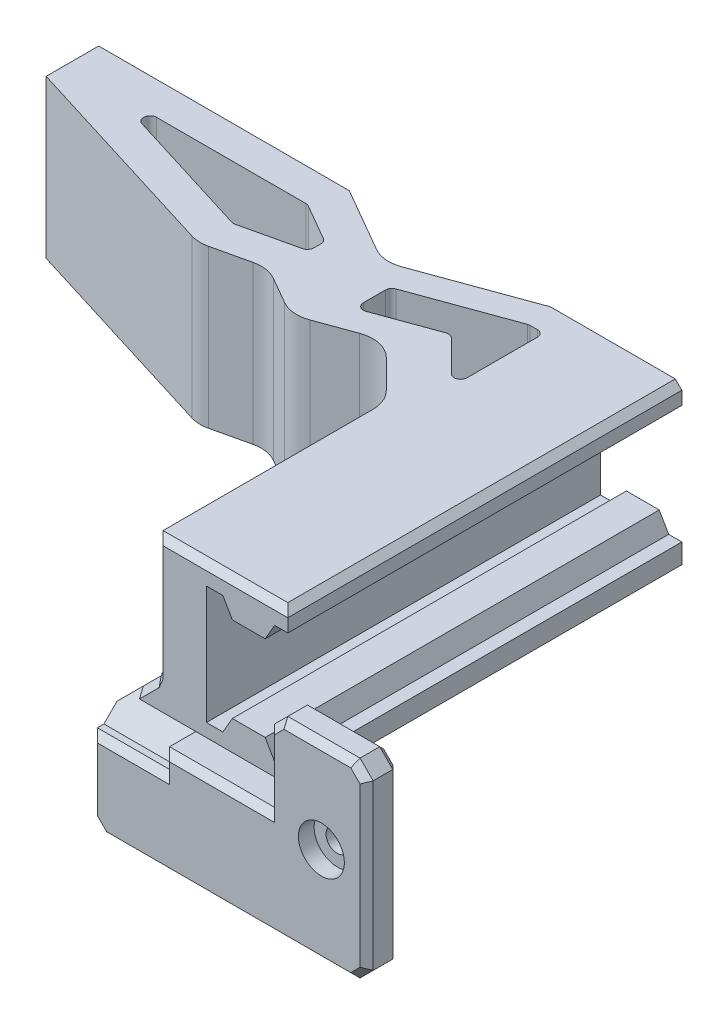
SolidWorks part; units mm, degrees
ref_plane "Front Plane" through (0, 0, 0) normal (0, 0, 1) x (1, 0, 0)
ref_plane "Top Plane" through (0, 0, 0) normal (0, 1, 0) x (1, 0, 0)
ref_plane "Right Plane" through (0, 0, 0) normal (1, 0, 0) x (0, 0, -1)
sketch "Sketch1" plane through (0, 0, 0) normal (0, 0, 1) x (1, 0, 0)
  line L0 (-1, -9) -> (-4.6132, -9) construction
  line L1 (-4.6132, -9) -> (-6.0566, -6.5) construction
  line L2 (-6.0566, -6.5) -> (-11.0566, -6.5) construction
  line L3 (-11.0566, -6.5) -> (-12.5, -9) construction
  line L4 (-12.5, -9) -> (-14, -9) construction
  line L5 (-15, -8) -> (-15, 8) construction
  line L6 (-4.6132, 9) -> (-1, 9) construction
  line L7 (-6.0566, 6.5) -> (-4.6132, 9) construction
  line L8 (-11.0566, 6.5) -> (-6.0566, 6.5) construction
  line L9 (-12.5, 9) -> (-11.0566, 6.5) construction
  line L10 (-14, 9) -> (-12.5, 9) construction
  line L11 (-2.6132, -9) -> (-4.6132, -9)
  line L12 (-4.6132, -9) -> (-6.0566, -6.5)
  line L13 (-6.0566, -6.5) -> (-11.0566, -6.5)
  line L14 (-11.0566, -6.5) -> (-12.5, -9)
  line L15 (-12.5, -9) -> (-14, -9)
  line L16 (-15, -8) -> (-15, 8)
  line L17 (-4.6132, 9) -> (-2.6132, 9)
  line L18 (-6.0566, 6.5) -> (-4.6132, 9)
  line L19 (-11.0566, 6.5) -> (-6.0566, 6.5)
  line L20 (-12.5, 9) -> (-11.0566, 6.5)
  line L21 (-14, 9) -> (-12.5, 9)
  line L22 (-14, -9) -> (-15, -9)
  line L23 (-15, -8) -> (-15, -9)
  line L24 (-14, 9) -> (-15, 9)
  line L25 (-15, 8) -> (-15, 9)
  line L26 (-2.6132, 9) -> (-2.6132, 12)
  line L27 (-2.6132, 12) -> (-22.6132, 12)
  line L28 (-22.6132, 12) -> (-22.6132, -12)
  line L29 (-22.6132, 0) -> (-15, 0) construction
  line L30 (-2.6132, -12) -> (-22.6132, -12)
  line L31 (-2.6132, -9) -> (-2.6132, -12)
  dimension "D1" = 2
  dimension "D2" = 3
  dimension "D3" = 20
extrude "Boss-Extrude1" add sketch "Sketch1" along normal mid plane 60
sketch "Sketch2" plane through (0, -12, 0) normal (0, -1, 0) x (1, 0, 0)
  line L1 (-22.6132, 30) -> (-27.6132, 30)
  line L2 (-22.6132, 30) -> (-22.6132, 5) construction
  line L3 (-22.6132, 5) -> (-27.6132, 5)
  line L4 (-27.6132, 30) -> (-27.6132, 5)
  line L5 (-22.6132, 30) -> (-14.6132, 30)
  line L6 (-22.6132, 30) -> (-22.6132, 5) construction
  line L7 (-22.6132, 5) -> (-14.6132, 5)
  line L8 (-14.6132, 30) -> (-14.6132, 5)
  dimension "D1" = 25
  dimension "D2" = 5
  dimension "D3" = 8
extrude "Boss-Extrude2" add sketch "Sketch2" along normal blind 15
chamfer "Chamfer1" distance 5 angle 45 2 edges at (-22.6132, -12, 17.5) (-14.6132, -12, 17.5)
sketch "Sketch3" plane through (0, 0, 30) normal (0, 0, 1) x (1, 0, 0)
  line L1 (-27.6132, -27) -> (14.3868, -27)
  line L2 (-27.6132, -27) -> (-27.6132, -14)
  line L3 (-27.6132, -14) -> (14.3868, -14)
  line L4 (14.3868, -27) -> (14.3868, -14)
  dimension "D1" = 13
  dimension "D2" = 42
extrude "Boss-Extrude3" add sketch "Sketch3" along normal blind 5
sketch "Sketch4" plane through (0, 0, 35) normal (0, 0, 1) x (1, 0, 0)
  line L1 (14.3868, -14) -> (-16.6132, -14)
  line L2 (14.3868, -14) -> (14.3868, -10.4295)
  line L3 (-0.6132, -11) -> (-16.6132, -11)
  line L4 (-16.6132, -14) -> (-16.6132, -11)
  line L6 (14.3868, -10.4295) -> (14.3868, 2)
  line L7 (14.3868, 2) -> (-0.6132, 2)
  line L8 (-0.6132, -11) -> (-0.6132, 2)
  dimension "D1" = 15
  dimension "D2" = 31
  dimension "D3" = 3
  dimension "D4" = 13
extrude "Boss-Extrude4" add sketch "Sketch4" against normal blind 5
chamfer "Chamfer2" distance 3 angle 45 2 edges at (-6.1132, -12, 30) (-22.1132, -14, 30)
chamfer "Chamfer3" distance 2 angle 45 4 edges at (14.3868, -27, 32.5) (14.3868, 2, 32.5) (-27.6132, -27, 20) (-0.6132, 2, 32.5)
chamfer "Chamfer4" distance 1 angle 45 32 edges at (-2.6132, 12, 0) (-22.6132, -7, 17.5) (-16.1132, -12, 5) (-22.6132, -9.5, 5) (-25.1132, -9.5, 5) (-27.6132, -18.5, 5) (-26.6132, -26, 5) (-20.1132, -27, 5) (-14.6132, -27, 17.5) (-14.6132, -22, 30) (-1.1132, -27, 30) (13.3868, -26, 30) (14.3868, -12.5, 30) (13.3868, 1, 30) (-0.6132, -5.5, 35) (-0.6132, -5.5, 30) (0.3868, 1, 30) (6.8868, 2, 35) (6.8868, 2, 30) (-26.6132, -26, 35) (-27.6132, -19.5, 35) (-22.1132, -14, 35) (-16.6132, -12.5, 35) (-8.6132, -11, 35) (0.3868, 1, 35) (13.3868, 1, 35) (14.3868, -12.5, 35) (13.3868, -26, 35) (-6.6132, -27, 35) (-24.6132, -9, 30) (-22.6132, 2.5, 30) (-12.6132, 12, 30)
sketch "Sketch5" plane through (0, 12, 0) normal (0, 1, 0) x (1, 0, 0)
  line L0 (-22.6132, 30) -> (-22.6132, 16)
  line L1 (-22.6132, 30) -> (-41.4071, 23.1596)
  line L2 (-22.6132, 16) -> (-41.4071, 9.1596)
  line L3 (-41.4071, 23.1596) -> (-41.4071, 9.1596)
  line L4 (-22.6132, -29) -> (-22.6132, 30) construction
  dimension "D1" = 14
  dimension "D2" = 20
  dimension "D3" = 70
extrude "Boss-Extrude5" add sketch "Sketch5" against normal up to surface (24 mm away)
chamfer "Chamfer5" distance 11 angle 45 1 edges at (-22.6132, 0, -16)
sketch "Sketch6" plane through (0, 12, 0) normal (0, 1, 0) x (1, 0, 0)
  line L11 (-32.046, 16.8235) -> (-26.5409, 18.8272)
  line L12 (-25.7282, 18.0144) -> (-17.6635, 9.9497)
  line L13 (-25.7282, 18.0144) -> (-19.6132, 11.8995)
  line L14 (-37.4071, 14.8722) -> (-32.046, 16.8235)
  line L15 (-37.4071, 20.3588) -> (-37.4071, 14.8722)
  line L16 (-21.9079, 26) -> (-37.4071, 20.3588)
  line L17 (-3.6132, 26) -> (-21.9079, 26)
  line L18 (-37.4071, 14.8722) -> (-32.046, 16.8235)
  line L19 (-37.4071, 20.3588) -> (-37.4071, 14.8722)
  line L20 (-21.9079, 26) -> (-37.4071, 20.3588)
  line L21 (-19.6132, 26) -> (-21.9079, 26)
  line L22 (-25.7282, 18.0144) -> (-26.5409, 18.8272)
  line L23 (-19.6132, 26) -> (-19.6132, 11.8995)
  line L24 (-2.6132, 30) -> (-2.6132, -30) construction
  dimension "D3" = 17
  dimension "D1" = 4
  dimension "D2" = 7
extrude "Cut-Extrude1" cut sketch "Sketch6" against normal through all
sketch "Sketch7" plane through (0, 12, 0) normal (0, 1, 0) x (1, 0, 0)
  line L0 (-22.6132, 30) -> (-72.4312, 30) construction
  line L1 (-41.4071, 23.1596) -> (-53.255, 30)
  line L2 (-53.255, 30) -> (-91.4071, 30)
  line L3 (-91.4071, 30) -> (-91.4071, 22)
  line L4 (-91.4071, 22) -> (-57.9734, 11.6469)
  line L5 (-57.9734, 11.6469) -> (-49.2013, 13.6596)
  line L6 (-49.2013, 13.6596) -> (-41.4071, 9.1596)
  line L7 (-41.4071, 23.1596) -> (-41.4071, 9.1596) construction
  line L8 (-48.4036, 21.4255) -> (-54.5948, 25)
  line L9 (-54.5948, 25) -> (-84.192, 25)
  line L10 (-84.192, 25) -> (-84.192, 25)
  line L11 (-84.192, 25) -> (-57.7799, 16.8212)
  line L12 (-57.7799, 16.8212) -> (-48.4036, 18.9725)
  line L14 (-48.4036, 18.9725) -> (-48.4036, 21.4255)
  line L16 (-43.9071, 18.8295) -> (-54.5948, 25) construction
  line L17 (-48.4036, 18.9725) -> (-38.9071, 13.4897) construction
  dimension "D1" = 50
  dimension "D2" = 8
  dimension "D3" = 35
  dimension "D4" = 9
  dimension "D5" = 9
  dimension "D6" = 60
  dimension "D7" = 5
extrude "Boss-Extrude6" add sketch "Sketch7" against normal up to surface (24 mm away) contours L5 L6 L1 L2 L3 L4 L14 L12 L11 L9 L8 M18
sketch "Sketch8" plane through (0, 0, -30) normal (0, 0, -1) x (-1, 0, 0)
  line L0 (91.4071, 0) -> (81.4071, 0) construction
  line L1 (91.4071, -12) -> (91.4071, 12) construction
  line L3 (76.4071, -5) -> (86.4071, -5)
  line L4 (76.4071, -5) -> (76.4071, 5)
  line L5 (76.4071, 5) -> (86.4071, 5)
  line L6 (86.4071, -5) -> (86.4071, 5)
  line L7 (76.4071, -5) -> (86.4071, 5) construction
  line L8 (76.4071, 5) -> (86.4071, -5) construction
  dimension "D1" = 10
  dimension "D2" = 10
  dimension "D3" = 10
extrude "Cut-Extrude2" cut sketch "Sketch8" against normal blind 5
fillet "Fillet1" radius 1 12 edges at (-84.192, -8.5, -25) (-84.192, 8.5, -25) (-57.7799, 0, -16.8212) (-54.5948, 0, -25) (-48.4036, 0, -18.9725) (-48.4036, 0, -21.4255) (-37.4071, 0, -14.8722) (-26.5409, 0, -18.8272) (-37.4071, 0, -20.3588) (-21.9079, 0, -26) (-19.6132, 0, -26) (-19.6132, 0, -11.8995)
fillet "Fillet2" radius 5 6 edges at (-57.9734, 0, -11.6469) (-49.2013, 0, -13.6596) (-41.4071, 0, -9.1596) (-30.6779, 0, -13.0647) (-22.6132, 0, -5) (-41.4071, 0, -23.1596)
hole_wizard "CBORE for M3 Pan Head Screw1" positions "3DSketch2" profile "Sketch10" counterbore size "M3" standard "ISO"
sketch3d "3DSketch2"
  circle A0 centre (7.5, -12, 30) radius 6 construction
  point P0 (7.5, -12, 35)
  point P5 (7.5, -12, 36)
sketch "Sketch10" plane through (7.5, -12, 35) normal (1, 0, 0) x (0, -1, 0)
  line L0 (0, 0) -> (0, 5)
  line L1 (0, 5) -> (1.7, 5)
  line L3 (1.7, 5) -> (1.7, 2.4)
  line L4 (1.7, 2.4) -> (3.5, 2.4)
  line L5 (3.5, 2.4) -> (3.5, 0)
  line L7 (3.5, 0) -> (0, 0)
  line L11 (0, -6.35) -> (0, 107.95) construction
  dimension "Thru Hole Dia." = 3.4
  dimension "Thru Hole Depth" = 5
  dimension "C'Bore Dia." = 7
  dimension "C'Bore Depth" = 2.4
